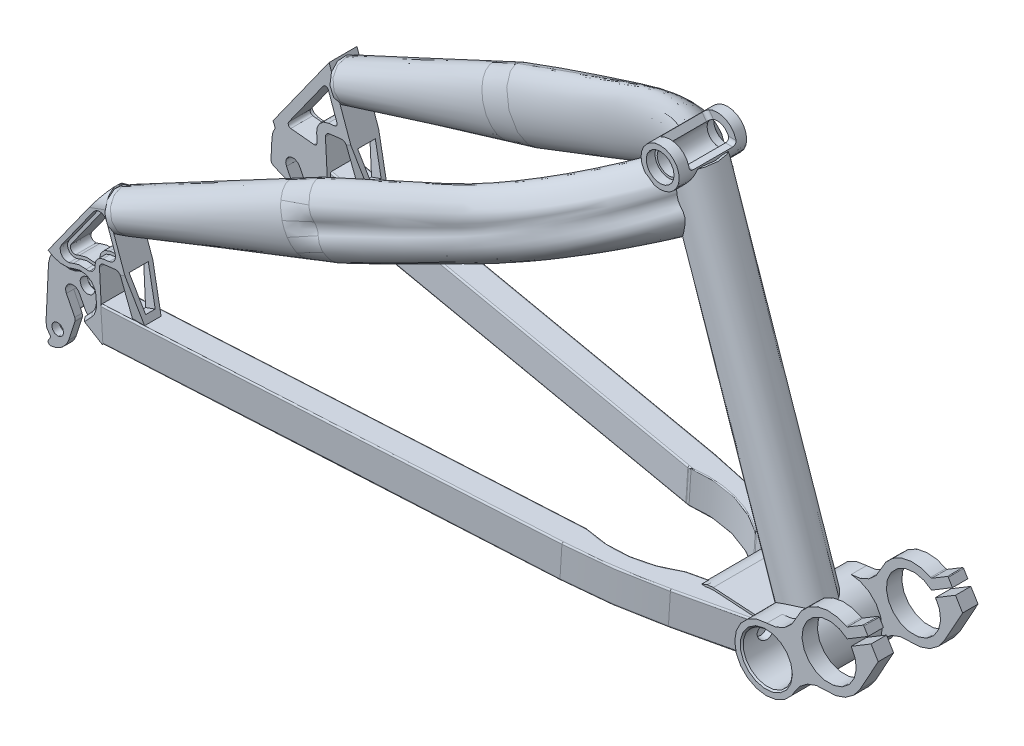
SolidWorks part; units mm, degrees
ref_plane "Face" through (0, 0, 0) normal (0, 0, 1) x (1, 0, 0)
ref_plane "Dessus" through (0, 0, 0) normal (0, 1, 0) x (1, 0, 0)
ref_plane "Droite" through (0, 0, 0) normal (1, 0, 0) x (0, 0, -1)
imported_body "Surface-Importée1"
imported_body "Importée1"
imported_body "Surface-Importée3"
imported_body "Importée2"
imported_body "Surface-Importée4"
imported_body "Importée3"
imported_body "Importée4"
imported_body "Surface-Importée5"
imported_body "Surface-Importée6"
imported_body "Surface-Importée7"
imported_body "Importée5"
sketch "Esquisse1" plane through (-328.6376, 234.9703, 0) normal (-0.8135, 0.5816, 0) x (0, 0, 1)
  line L1 (-38.007, -174.4836) -> (-123.3561, -174.4836)
  line L2 (-38.007, -174.4836) -> (-38.007, -285.8375)
  line L3 (-38.007, -285.8375) -> (-123.3561, -285.8375)
  line L4 (-123.3561, -174.4836) -> (-123.3561, -285.8375)
extrude "Enlèv. mat.-Extru.1" cut sketch "Esquisse1" along normal through all
sketch "Esquisse2" plane through (-5.933, 9.8514, 0) normal (-0.5159, 0.8566, 0) x (-0.8566, -0.5159, 0)
  circle A0 centre (-28.32, -28.75) radius 3.5
  circle A1 centre (-28.32, -28.75) radius 3 construction
  circle A2 centre (-28.32, 28.75) radius 3.5
  circle A3 centre (-28.32, 28.75) radius 3.2 construction
  dimension "D1" = 7
extrude "Agrandissement trou" cut sketch "Esquisse2" against normal up to next
sketch "Esquisse3" plane through (-5.933, 9.8514, 0) normal (-0.5159, 0.8566, 0) x (-0.8566, -0.5159, 0)
  circle A0 centre (-28.32, 28.75) radius 3.5 construction
  circle A1 centre (-28.32, 28.75) radius 3.5
  circle A2 centre (-28.32, -28.75) radius 3.5 construction
  circle A3 centre (-28.32, -28.75) radius 3.5
extrude "Extrusion1" [suppressed] add sketch "Esquisse3" against normal up to surface (6 mm away)
sketch "Esquisse4" plane through (-0.7739, 1.285, 0) normal (-0.5159, 0.8566, 0) x (-0.8566, -0.5159, 0)
  circle A0 centre (-28.32, 28.75) radius 3 construction
  circle A1 centre (-28.32, -28.75) radius 3 construction
  circle A2 centre (-28.32, 28.75) radius 3
  circle A3 centre (-28.32, -28.75) radius 3
extrude "Extrusion2" [suppressed] add sketch "Esquisse4" against normal blind 20
sketch "Esquisse5" plane through (0, 0, -34) normal (0, 0, -1) x (-1, 0, 0)
  line L0 (-21.002, -11.6153) -> (-33.4756, 10.9387) construction
  line L1 (-21.002, -11.6153) -> (-33.4756, 10.9387)
  line L2 (-21.002, -11.6153) -> (-45.3323, 3.7348)
  line L3 (-33.4756, 10.9387) -> (-45.3323, 3.7348)
  circle A0 centre (0, 0) radius 18.5
  arc A1 (-15.0218, 10.7979) -> (-12.2938, 13.8244) centre (0, 0) ccw construction
extrude "Enlèv. mat.-Extru.2" [suppressed] cut sketch "Esquisse5" against normal through all
